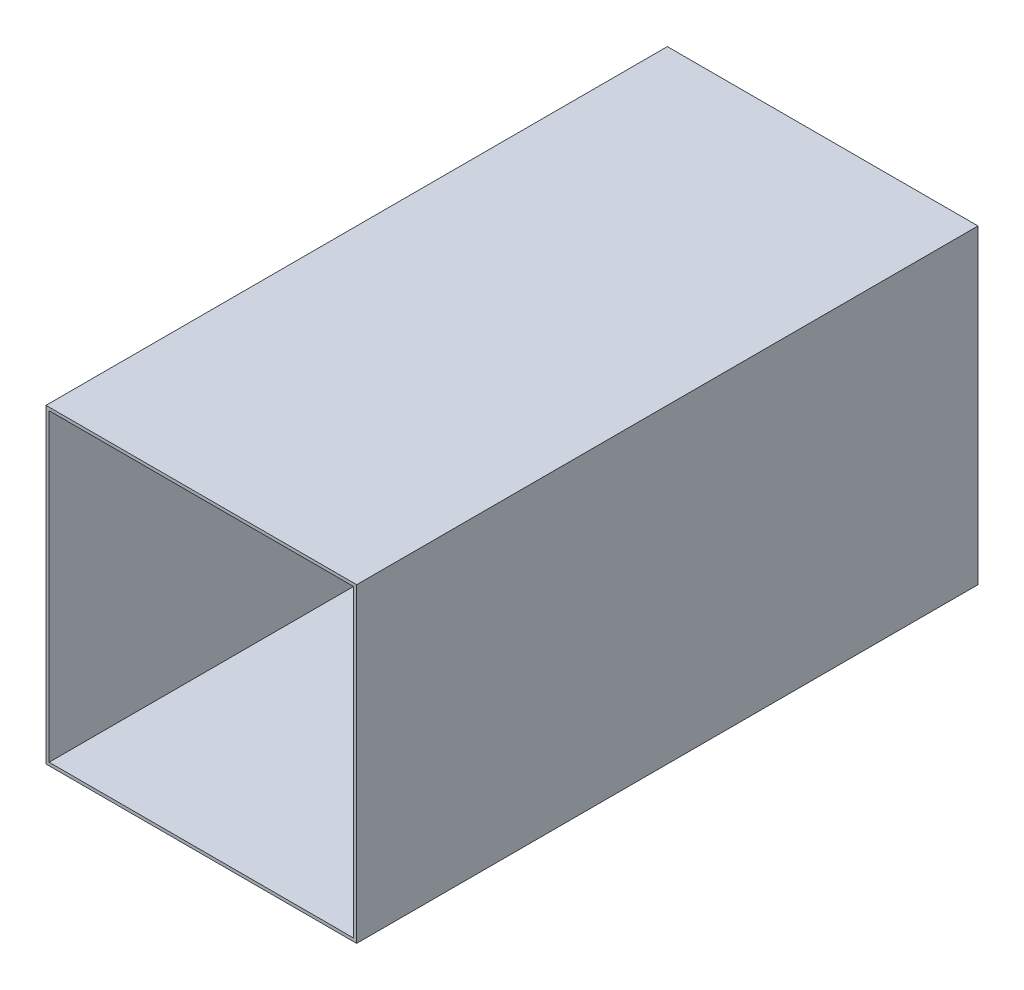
SolidWorks part; units mm, degrees
ref_plane "Front Plane" through (0, 0, 0) normal (0, 0, 1) x (1, 0, 0)
ref_plane "Top Plane" through (0, 0, 0) normal (0, 1, 0) x (1, 0, 0)
ref_plane "Right Plane" through (0, 0, 0) normal (1, 0, 0) x (0, 0, -1)
sketch "Sketch1" plane through (0, 0, 0) normal (0, 0, 1) x (1, 0, 0)
  line L0 (2.54, 251.46) -> (251.46, 251.46)
  line L1 (0, 0) -> (254, 0)
  line L2 (0, 0) -> (0, 254)
  line L3 (0, 254) -> (254, 254)
  line L4 (254, 0) -> (254, 254)
  line L5 (251.46, 2.54) -> (251.46, 251.46)
  line L6 (2.54, 2.54) -> (251.46, 2.54)
  line L7 (2.54, 2.54) -> (2.54, 251.46)
  dimension "D1" = 254
  dimension "D2" = 254
  dimension "D3" = 2.54
extrude "Boss-Extrude1" add sketch "Sketch1" along normal mid plane 508
